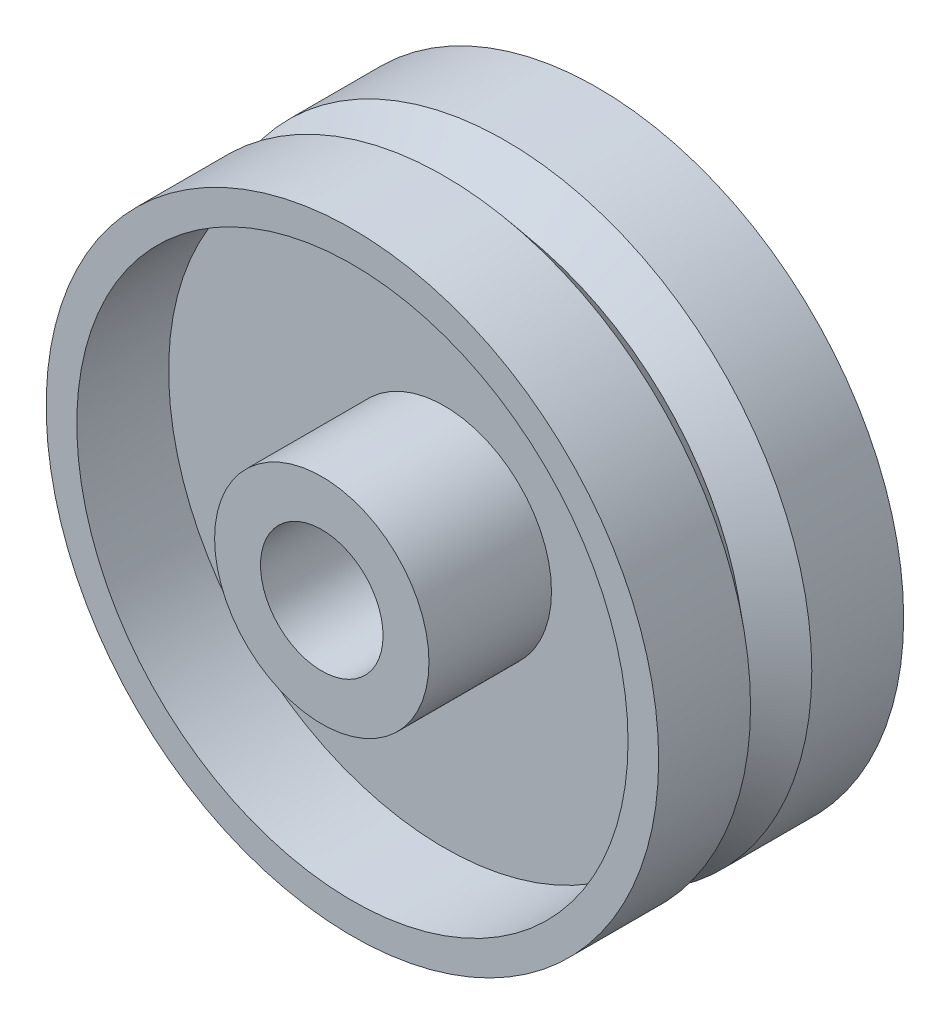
SolidWorks part; units mm, degrees
ref_plane "Front Plane" through (0, 0, 0) normal (0, 0, 1) x (1, 0, 0)
ref_plane "Top Plane" through (0, 0, 0) normal (0, 1, 0) x (1, 0, 0)
ref_plane "Right Plane" through (0, 0, 0) normal (1, 0, 0) x (0, 0, -1)
sketch "Sketch1" plane through (0, 0, 0) normal (1, 0, 0) x (0, 0, -1)
  line L0 (0, 0) -> (89.1189, 0) construction
  line L1 (0, 0) -> (0, 100) construction
  line L2 (-25, 10) -> (25, 10)
  line L3 (25, 10) -> (25, 17.5)
  line L4 (25, 17.5) -> (5, 17.5)
  line L5 (5, 17.5) -> (5, 45)
  line L6 (5, 45) -> (20, 45)
  line L7 (20, 45) -> (20, 50)
  line L8 (20, 50) -> (-20, 50)
  line L9 (-20, 50) -> (-20, 45)
  line L10 (-20, 45) -> (-5, 45)
  line L11 (-5, 45) -> (-5, 17.5)
  line L12 (-5, 17.5) -> (-25, 17.5)
  line L13 (-25, 17.5) -> (-25, 10)
  point P17 (0, 50)
  dimension "D1" = 50
  dimension "D2" = 40
  dimension "D3" = 5
  dimension "D4" = 10
  dimension "D5" = 100
  dimension "D6" = 20
  dimension "D7" = 35
revolve "Revolve1" add sketch "Sketch1" angle 360 about L0
sketch "Sketch2" plane through (0, 0, 0) normal (1, 0, 0) x (0, 0, -1)
  line L0 (0, 0) -> (0, 62.4123) construction
  line L1 (-5, 50) -> (5, 50)
  line L2 (20, 50) -> (-20, 50) construction
  line L3 (5, 50) -> (0, 44.0412)
  line L4 (0, 44.0412) -> (-5, 50)
  line L5 (0, 0) -> (57.5405, 0) construction
  point P7 (0, 50)
  dimension "D1" = 10
  dimension "D2" = 80
revolve "Cut-Revolve1" cut sketch "Sketch2" angle 360 about L5
